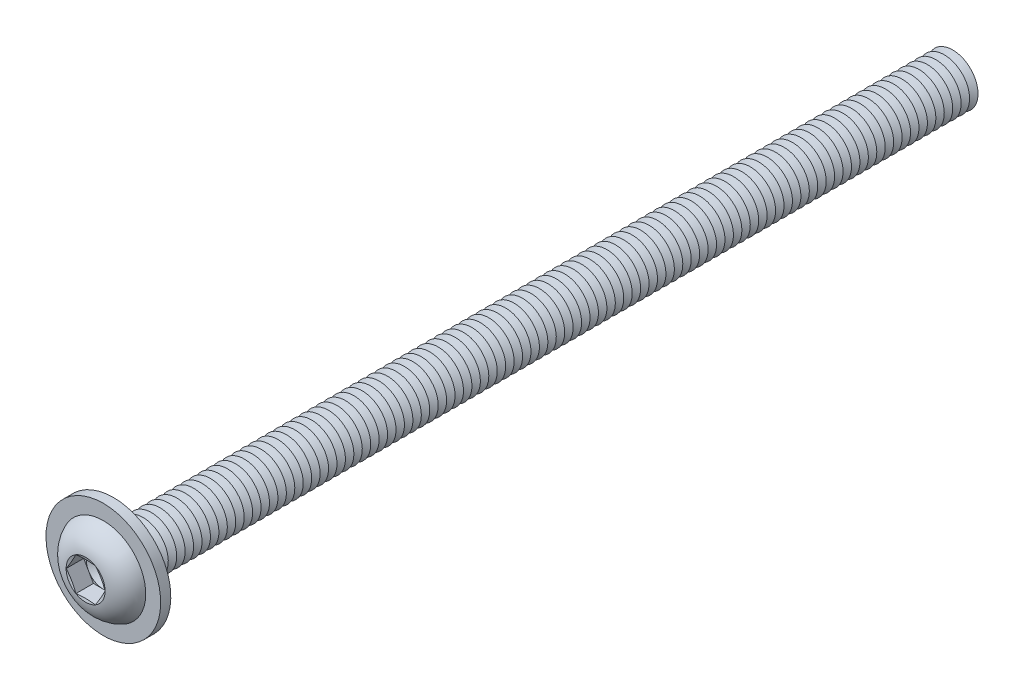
SolidWorks part; units mm, degrees
ref_plane "Front Plane" through (0, 0, 0) normal (0, 0, 1) x (1, 0, 0)
ref_plane "Top Plane" through (0, 0, 0) normal (0, 1, 0) x (1, 0, 0)
ref_plane "Right Plane" through (0, 0, 0) normal (1, 0, 0) x (0, 0, -1)
sketch "Sketch1" plane through (0, 0, 0) normal (1, 0, 0) x (0, 0, -1)
  line L0 (0, 3) -> (0, 5.25)
  line L3 (0, 3) -> (100, 3)
  line L4 (100, 3) -> (100, 0)
  line L5 (100, 0) -> (-3.3, 0) construction
  line L6 (-3.3, 0) -> (100, 0)
  line L7 (-3.3, 2.3094) -> (-3.3, 1.1547) construction
  line L8 (-3.3, 1.1547) -> (-3.3, 0)
  line L9 (-3.3, 2.3094) -> (-2.9906, 1.1547)
  line L10 (-2.9906, 1.1547) -> (-3.3, 1.1547)
  line L11 (100, 0) -> (22.7481, 0) construction
  line L12 (0, 5.25) -> (-3.3, 5.25) construction
  arc A1 (0, 5.25) -> (-3.3, 2.3094) centre (0, 1.928) ccw
  point P8 (100, 1.5)
  dimension "D1" = 10.5
  dimension "D2" = 6
  dimension "D3" = 3.3
  dimension "D4" = 4.6188
  dimension "D5" = 100
  dimension "D6" = 15
revolve "Revolve1" add sketch "Sketch1" angle 360 about L5
fillet "Fillet1" radius 0.5 1 edges at (0, 3, 0)
sketch "Sketch2" plane through (0, 0, 0) normal (1, 0, 0) x (0, 0, -1)
  line L0 (99.5, 3) -> (100.5, 3)
  line L1 (100, 3) -> (0.5, 3) construction
  line L2 (100.5, 3) -> (100, 2.134)
  line L3 (100, -3) -> (100, 3) construction
  line L4 (100, 2.134) -> (99.5, 3)
  dimension "D1" = 1
revolve "Cut-Revolve1" cut sketch "Sketch2" angle 360 about axis through (0, 0, -100) along (0, 0, -1)
pattern_linear "LPattern1" count 100 spacing 1 along (0, 0, 1) of "Cut-Revolve1"
sketch "Sketch3" plane through (0, 0, 3.3) normal (0, 0, 1) x (1, 0, 0)
  line L7 (1.1547, 2) -> (-1.1547, 2)
  line L8 (-1.1547, 2) -> (-2.3094, 0)
  line L9 (-2.3094, 0) -> (-1.1547, -2)
  line L10 (-1.1547, -2) -> (1.1547, -2)
  line L11 (1.1547, -2) -> (2.3094, 0)
  line L12 (2.3094, 0) -> (1.1547, 2)
  circle A0 centre (0, 0) radius 2 construction
  circle A3 centre (0, 0) radius 2.3094 construction
extrude "Cut-Extrude1" cut sketch "Sketch3" against normal blind 2.08
sketch "Sketch4" plane through (0, 0, 1.22) normal (0, 0, 1) x (1, 0, 0)
  line L1 (1.1547, 2) -> (-1.1547, 2) construction
  circle A0 centre (0, 0) radius 2
extrude "Cut-Extrude2" cut sketch "Sketch4" against normal through all draft 60
sketch "Sketch5" plane through (0, 0, 0) normal (0, 0, -1) x (-1, 0, 0)
  circle A0 centre (0, 0) radius 6.8
  circle A1 centre (0, 0) radius 3.5
  circle A2 centre (0, 0) radius 3.5 construction
  dimension "D1" = 13.6
extrude "Boss-Extrude1" add sketch "Sketch5" against normal blind 1.2
